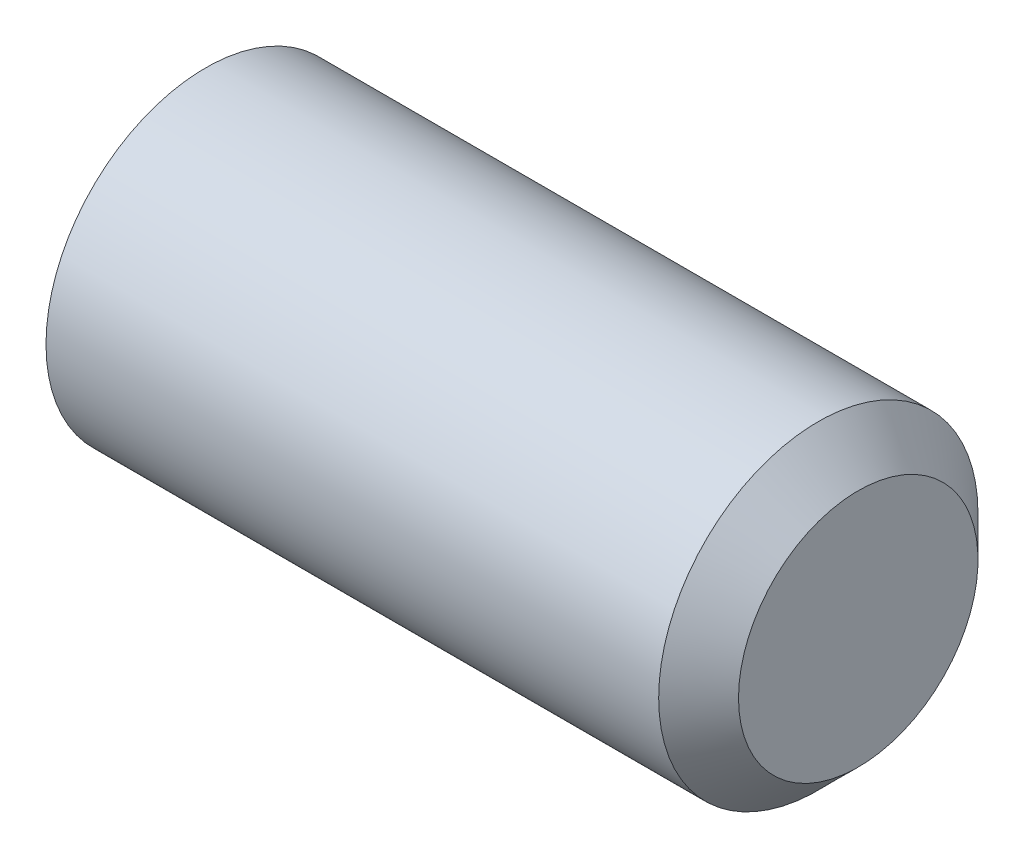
SolidWorks part; units mm, degrees
revolve "BaseBody" add sketch "BodySke" angle 360 about L5
sketch "BodySke" plane through (0, 0, 0) normal (0, 0, 1) x (1, 0, 0)
  line L0 (0, 0) -> (0, 10.352)
  line L1 (0, 10.352) -> (0.9515, 12)
  line L2 (0.9515, 12) -> (47, 12)
  line L3 (47, 12) -> (50, 9)
  line L4 (50, 0) -> (0, 0)
  line L5 (-12.7, 0) -> (88.9, 0) construction
  line L6 (50, 9) -> (50, 0)
  line L7 (50, 9) -> (50, 18.525) construction
  line L8 (0, -10.352) -> (0.9515, -12) construction
  line L9 (3, 15.875) -> (3, -3.175) construction
  line L10 (47, -12) -> (50, -9) construction
ref_plane "Plane1" through (0, 0, 0) normal (0, 0, 1) x (1, 0, 0)
ref_plane "Plane2" through (0, 0, 0) normal (0, 1, 0) x (1, 0, 0)
ref_plane "Plane3" through (0, 0, 0) normal (1, 0, 0) x (0, 0, -1)
other "Configuration Table"
sketch "Sketch2" plane through (0, 0, 0) normal (-1, 0, 0) x (0, 0, 1)
  line L0 (3.4641, 6) -> (-3.4641, 6)
  line L1 (-3.4641, 6) -> (-6.9282, 0)
  line L2 (3.4641, 6) -> (6.9282, 0)
  line L3 (3.4641, -6) -> (6.9282, 0)
  line L4 (3.4641, -6) -> (-3.4641, -6)
  line L5 (-3.4641, -6) -> (-6.9282, 0)
extrude "Hex" cut sketch "Sketch2" against normal blind 15
sketch "ThdSchSke" plane through (0, 0, 0) normal (0, 0, 1) x (1, 0, 0)
  line L0 (0.9515, -10.352) -> (-0.2025, -12)
  line L1 (0.9515, -10.352) -> (2.1054, -12)
  line L2 (2.1054, -12) -> (2.1054, -15)
  line L3 (-3.175, 0) -> (5.1513, 0) construction
  line L5 (2.1054, -15) -> (-0.2025, -15)
  line L6 (-0.2025, -15) -> (-0.2025, -12)
  line L8 (0.9515, 12) -> (0.9515, -12) construction
revolve "ThreadSchematic" [suppressed] cut sketch "ThdSchSke" angle 360 about L3
pattern_linear "ThdSchPat" [suppressed]
equation "\"D2@Sketch2\" = \"Hex_size@Sketch2\" / 2"
equation "\"D3@Sketch2\" = \"Hex_size@Sketch2\" / 2"
equation "\"Thread_minor@ThreadCosmetic\" = \"Minor_dia@BodySke\""
equation "\"Thread_minor@ThdSchSke\" = \"Thread_minor@ThreadCosmetic\""
equation "\"Diameter@ThdSchSke\" = \"Diameter@BodySke\""
equation "\"Overcut@ThdSchSke\" = \"Diameter@BodySke\" * 1.25"
equation "\"Num_threads@ThdSchPat\" = int( (\"Length@BodySke\" - ( ( ( \"Diameter@BodySke\" - \"Minor_dia@BodySke\" ) * 0.5 ) / tan( \"Drive_ch_ang@BodySke\" * 0.017453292 ) ) - ( ( ( \"Diameter@BodySke\" - \"Cup_dia@BodySk"
equation "\"Advance@ThdSchPat\" = (\"Length@BodySke\" - ( ( ( \"Diameter@BodySke\" - \"Minor_dia@BodySke\" ) * 0.5 ) / tan( \"Drive_ch_ang@BodySke\" * 0.017453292 ) ) - ( ( ( \"Diameter@BodySke\" - \"Cup_dia@BodySke\" ) * 0."
equation "' \"Num_threads@ThdSchPat\" = \"Num_threads@ThdSchPat\" - sgn( \"Num_threads@ThdSchPat\" - 1) '---chamfered tips only---"
